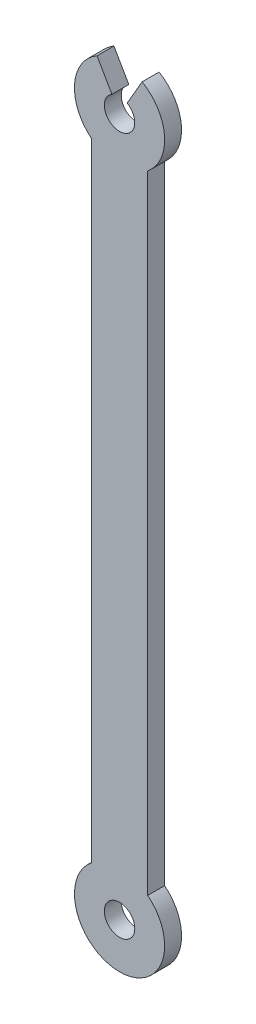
SolidWorks part; units mm, degrees
ref_plane "前视基准面" through (0, 0, 0) normal (0, 0, 1) x (1, 0, 0)
ref_plane "上视基准面" through (0, 0, 0) normal (0, 1, 0) x (1, 0, 0)
ref_plane "右视基准面" through (0, 0, 0) normal (1, 0, 0) x (0, 0, -1)
other "Configuration Table"
sketch "草图1" plane through (0, 0, 0) normal (0, 0, 1) x (1, 0, 0)
  line L0 (0, 0) -> (2.5, 0) construction
  line L1 (0, 0) -> (-2.5, 0) construction
  line L2 (0, 0) -> (0, -61.9) construction
  line L3 (0, -61.9) -> (2.5, -61.9) construction
  line L4 (0, -61.9) -> (-2.5, -61.9) construction
  line L5 (-2.5, -58.7775) -> (-2.5, -3.1225)
  line L6 (2.5, -3.1225) -> (2.5, -58.7775)
  line L7 (-2.5, 0) -> (-2.5, -3.1225) construction
  line L8 (2.5, 0) -> (2.5, -3.1225) construction
  line L9 (-2.5, -58.7775) -> (-2.5, -61.9) construction
  line L10 (2.5, -58.7775) -> (2.5, -61.9) construction
  line L11 (-0.675, 1.1691) -> (-2, 3.4641)
  line L12 (0.675, 1.1691) -> (2, 3.4641)
  line L13 (-0.675, 1.1691) -> (0, 0) construction
  line L14 (0, 0) -> (0.675, 1.1691) construction
  circle A0 centre (0, 0) radius 1.35
  arc A1 (2.5, -3.1225) -> (2, 3.4641) centre (0, 0) ccw
  circle A2 centre (0, -61.9) radius 1.35
  arc A3 (-2.5, -58.7775) -> (2.5, -58.7775) centre (0, -61.9) ccw
  arc A4 (-2, 3.4641) -> (-2.5, -3.1225) centre (0, 0) ccw
  dimension "D1" = 2.7
  dimension "D2" = 8
  dimension "D5" = 2.7
  dimension "D7" = 8
  dimension "D3" = 2.5
  dimension "D4" = 2.5
  dimension "D6" = 61.9
  dimension "D8" = 2.5
  dimension "D9" = 2.5
  dimension "D10" = 150
  dimension "D11" = 150
  dimension "D12" = 150
extrude "凸台-拉伸1" add sketch "草图1" along normal blind 1.5 contours L11 A4 L5 A3 L6 A1 L12 A0 A2
equation "\"1。5\"=10"
